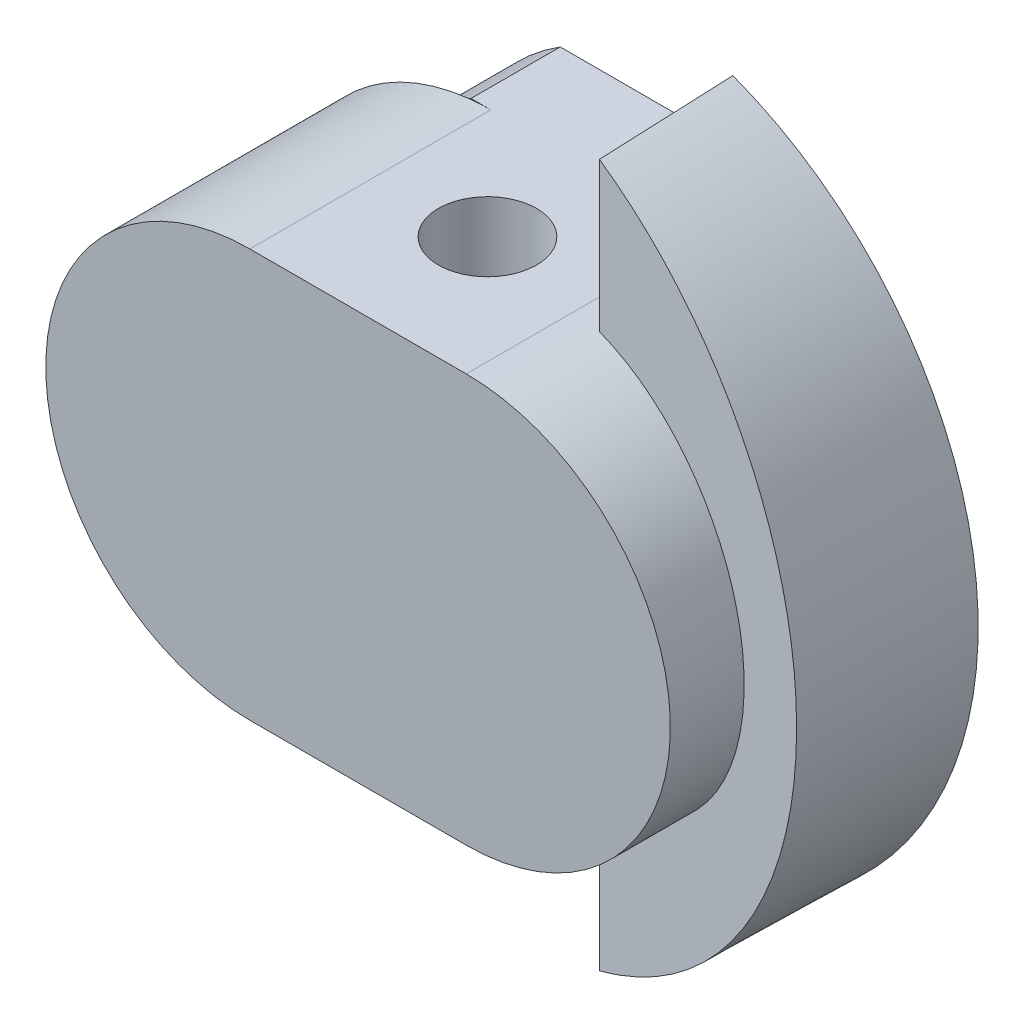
SolidWorks part; units mm, degrees
ref_plane "Plan de face" through (0, 0, 0) normal (0, 0, 1) x (1, 0, 0)
ref_plane "Plan de dessus" through (0, 0, 0) normal (0, 1, 0) x (1, 0, 0)
ref_plane "Plan de droite" through (0, 0, 0) normal (1, 0, 0) x (0, 0, -1)
sketch "Esquisse3" plane through (0, 0, 0) normal (0, 0, 1) x (1, 0, 0)
  line L0 (10, 12.533) -> (10, -3.373)
  arc A0 (10, -3.373) -> (10, 12.533) centre (7, 4.58) ccw
  dimension "D2" = 8.5
  dimension "D1" = 3
extrude "Extrusion3" add sketch "Esquisse3" along normal blind 4 draft 1 separate body
sketch "Esquisse5" plane through (0, 0, 0) normal (0, 1, 0) x (1, 0, 0)
  line L0 (7, -2.5) -> (15.4302, -4)
extrude "Enlèv. mat.-Extru.2" cut sketch "Esquisse5" against normal through all and the other way through all flip side to cut
sketch "Esquisse1" plane through (0, 0, 0) normal (0, 0, 1) x (1, 0, 0)
  line L1 (4.575, 0.005) -> (9.425, 0.005)
  line L3 (4.575, 9.155) -> (9.425, 9.155)
  arc A0 (4.575, 9.155) -> (4.575, 0.005) centre (4.575, 4.58) ccw
  arc A1 (9.425, 0.005) -> (9.425, 9.155) centre (9.425, 4.58) ccw
  dimension "D2" = 4.85
  dimension "D3" = 4.575
  dimension "D1" = 9.15
  dimension "D4" = 4.58
extrude "Extrusion1" add sketch "Esquisse1" along normal blind 5.4
sketch "Esquisse2" plane through (0, 0, 0) normal (0, 0, -1) x (-1, 0, 0)
  line L0 (-9.425, 4.58) -> (-4.575, 4.58) construction
  line L1 (-9.8687, 9.155) -> (-4.1313, 9.155)
  line L2 (-9.425, 9.155) -> (-4.575, 9.155) construction
  line L3 (-9.8687, 0.005) -> (-4.1313, 0.005)
  line L4 (-4.575, 0.005) -> (-9.425, 0.005) construction
  arc A0 (-4.1313, 0.005) -> (-4.1313, 9.155) centre (-7, 4.58) ccw
  arc A1 (-10, 0.0413) -> (-9.425, 0.005) centre (-9.425, 4.58) ccw construction
  arc A2 (-10, 0.0413) -> (-9.425, 0.005) centre (-9.425, 4.58) ccw construction
  arc A3 (-4.575, 0.005) -> (-4.575, 9.155) centre (-4.575, 4.58) ccw construction
  arc A4 (-4.575, 0.005) -> (-4.575, 9.155) centre (-4.575, 4.58) ccw construction
  arc A5 (-9.8687, 9.155) -> (-9.8687, 0.005) centre (-7, 4.58) ccw
  dimension "D1" = 10.8
extrude "Extrusion2" add sketch "Esquisse2" along normal blind 2
sketch "Esquisse4" plane through (0, 0.005, 0) normal (0, -1, 0) x (1, 0, 0)
  line L0 (9.8687, -2) -> (4.1313, -2) construction
  line L1 (7, 2.5) -> (7, -2) construction
  circle A0 centre (7, 2.5) radius 1.1
  dimension "D2" = 2.2
  dimension "D1" = 4.5
extrude "Enlèv. mat.-Extru.3" cut sketch "Esquisse4" against normal through all
sketch "Esquisse6" plane through (0, 0, -2) normal (0, 0, -1) x (-1, 0, 0)
  circle A0 centre (-7, 4.58) radius 1.75
  arc A1 (-9.8687, 9.155) -> (-9.8687, 0.005) centre (-7, 4.58) ccw construction
  arc A2 (-9.8687, 9.155) -> (-9.8687, 0.005) centre (-7, 4.58) ccw construction
  dimension "D1" = 3.5
extrude "Enlèv. mat.-Extru.4" cut sketch "Esquisse6" against normal blind 5.9
